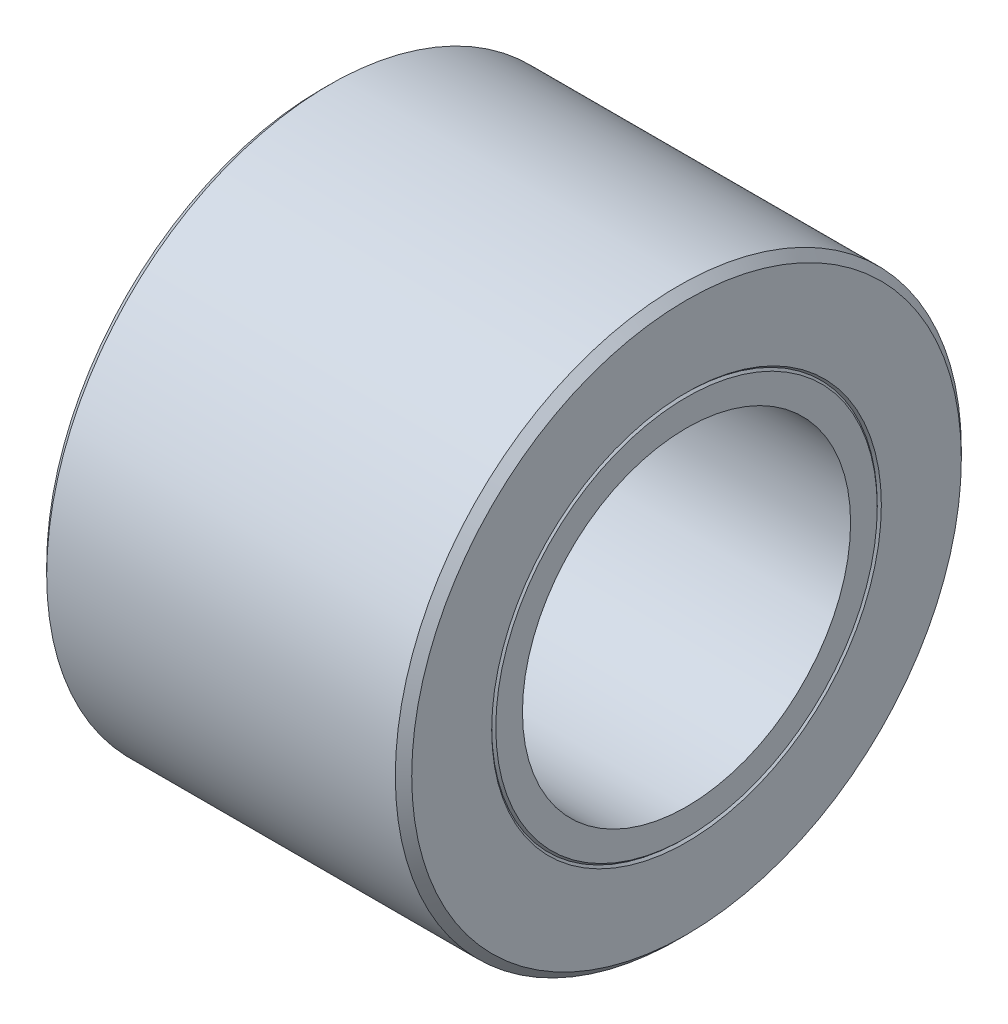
SolidWorks part; units mm, degrees
ref_plane "Plan de face" through (0, 0, 0) normal (0, 0, 1) x (1, 0, 0)
ref_plane "Plan de dessus" through (0, 0, 0) normal (0, 1, 0) x (1, 0, 0)
ref_plane "Plan de droite" through (0, 0, 0) normal (1, 0, 0) x (0, 0, -1)
sketch "Esquisse1" plane through (0, 0, 0) normal (0, 0, 1) x (1, 0, 0)
  line L0 (0, 0) -> (26.7542, 0) construction
  line L1 (0, 2) -> (4.45, 2)
  line L2 (0, 2) -> (0, 3.35)
  line L3 (0.1, 3.45) -> (4.35, 3.45)
  line L4 (4.45, 2) -> (4.45, 3.35)
  line L5 (0, 3.35) -> (0.1, 3.45)
  line L6 (4.35, 3.45) -> (4.45, 3.35)
  line L7 (0, 3.35) -> (0, 0) construction
  point P1 (4.45, 3.45)
  point P2 (0, 3.45)
  dimension "D1" = 4
  dimension "D2" = 6.9
  dimension "D3" = 4.45
  dimension "D6" = 0.1
  dimension "D7" = 0.1
revolve "Révolution1" add sketch "Esquisse1" angle 360 about L0
sketch "Esquisse2" plane through (4.45, 0, 0) normal (1, 0, 0) x (0, 0, -1)
  circle A0 centre (0, 0) radius 2.375
  circle A1 centre (0, 0) radius 2.325
  dimension "D1" = 4.75
  dimension "D2" = 4.65
extrude "Enlèv. mat.-Extru.1" cut sketch "Esquisse2" against normal blind 0.1 draft 45
